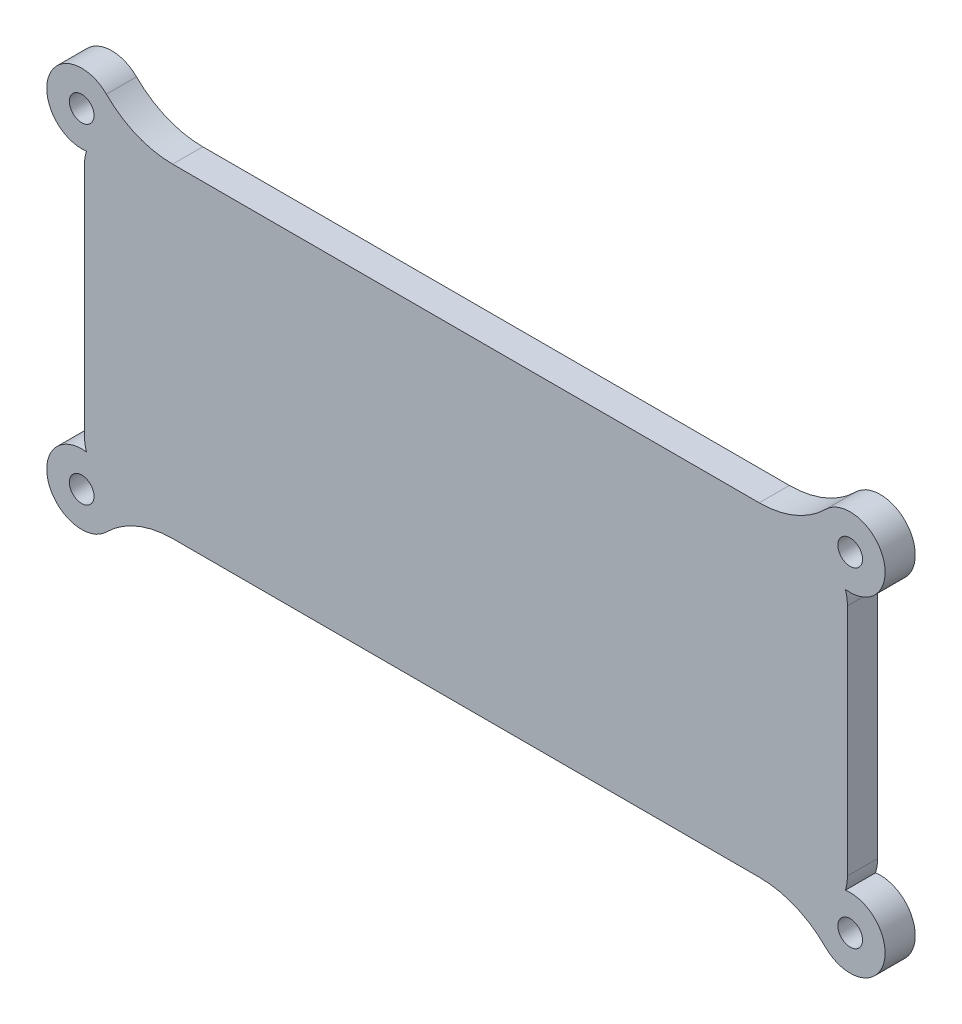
SolidWorks part; units mm, degrees
ref_plane "Front Plane" through (0, 0, 0) normal (0, 0, 1) x (1, 0, 0)
ref_plane "Top Plane" through (0, 0, 0) normal (0, 1, 0) x (1, 0, 0)
ref_plane "Right Plane" through (0, 0, 0) normal (1, 0, 0) x (0, 0, -1)
sketch "Sketch1" plane through (0, 0, 0) normal (0, 0, 1) x (1, 0, 0)
  line L1 (-127.6365, -9.672) -> (-127.6365, 29.788)
  line L4 (1.0748, -9.672) -> (1.0748, 29.788)
  line L5 (-112.7563, -17.292) -> (-13.8054, -17.292)
  line L7 (-13.8054, 37.408) -> (-112.7563, 37.408)
  circle A0 centre (1.537, -17.7542) radius 2.0828
  arc A15 (-13.8054, 37.408) -> (-2.6298, 42.0371) centre (-13.8054, 53.2126) ccw
  circle A16 centre (1.537, 37.8702) radius 2.0828
  arc A17 (0.7369, 32.032) -> (-2.6298, 42.0371) centre (1.537, 37.8702) ccw
  arc A20 (-2.6298, -21.9211) -> (0.7369, -11.916) centre (1.537, -17.7542) ccw
  arc A21 (-2.6298, -21.9211) -> (-13.8054, -17.292) centre (-13.8054, -33.0966) ccw
  circle A22 centre (-128.0987, -17.7542) radius 2.0828
  arc A23 (-112.7563, -17.292) -> (-123.9319, -21.9211) centre (-112.7563, -33.0966) ccw
  arc A24 (-127.2986, -11.916) -> (-123.9319, -21.9211) centre (-128.0987, -17.7542) ccw
  arc A27 (-123.9319, 42.0371) -> (-112.7563, 37.408) centre (-112.7563, 53.2126) ccw
  circle A28 centre (-128.0987, 37.8702) radius 2.0828
  arc A29 (-123.9319, 42.0371) -> (-127.2986, 32.032) centre (-128.0987, 37.8702) ccw
  spline S1 degree 3 poles (-127.6365, 29.788) (-127.6365, 30.261) (-127.5634, 31.0259) (-127.386, 31.7482) (-127.2986, 32.032) knots 0.511301 0.511301 0.511301 0.511301 0.517169 0.521126 0.521126 0.521126 0.521126
  spline S2 degree 2 poles (1.0748, 29.788) (1.0748, 30.8299) (0.7949, 31.8343) (0.7672, 31.9337) (0.7369, 32.032) knots 0 0 0 0.25 0.25 0.275715 0.275715 0.275715
  spline S3 degree 2 poles (-127.6365, -9.672) (-127.6365, -10.7139) (-127.3566, -11.7183) (-127.3289, -11.8177) (-127.2986, -11.916) knots 0 0 0 0.25 0.25 0.275715 0.275715 0.275715
  spline S5 degree 3 poles (1.0748, -9.672) (1.0748, -10.145) (1.0017, -10.9098) (0.8244, -11.6321) (0.7369, -11.916) knots 0.011301 0.011301 0.011301 0.011301 0.017169 0.021126 0.021126 0.021126 0.021126
extrude "Boss-Extrude1" add sketch "Sketch1" along normal blind 5.08
sketch "Sketch2" plane through (0, 0, 0) normal (0, 0, -1) x (-1, 0, 0)
  line L0 (54.8952, 15.138) -> (54.8952, 29.788)
  line L1 (54.8952, 29.788) -> (120.0165, 29.788)
  line L2 (120.0165, 29.788) -> (120.0165, -9.672)
  line L3 (120.0165, -9.672) -> (54.8952, -9.672)
  line L4 (54.8952, -9.672) -> (54.8952, 4.978)
  line L5 (53.6252, 15.138) -> (53.6252, 31.058)
  line L6 (53.6252, 31.058) -> (121.2865, 31.058)
  line L7 (121.2865, 31.058) -> (121.2865, -10.942)
  line L8 (121.2865, -10.942) -> (53.6252, -10.942)
  line L9 (53.6252, -10.942) -> (53.6252, 4.978)
  line L10 (53.6252, 4.978) -> (54.8952, 4.978)
  line L11 (53.6252, 15.138) -> (54.8952, 15.138)
  circle A1 centre (26.2752, 10.058) radius 4.5
  dimension "D1" = 1.27
extrude "Boss-Extrude2" add sketch "Sketch2" along normal blind 1.778
sketch "Sketch3" plane through (0, 0, 5.08) normal (0, 0, 1) x (1, 0, 0)
  line L12 (-13.8054, 37.408) -> (-6.5452, 37.408)
  line L13 (1.0748, 29.788) -> (1.0748, 22.5278)
  line L14 (1.0748, -2.4118) -> (1.0748, 22.5278)
  line L15 (1.0748, -2.4118) -> (1.0748, -9.672)
  line L16 (-6.5452, -17.292) -> (-13.8054, -17.292)
  line L17 (-112.7563, -17.292) -> (-13.8054, -17.292)
  line L18 (-112.7563, -17.292) -> (-120.0165, -17.292)
  line L19 (-127.6365, -9.672) -> (-127.6365, -2.4118)
  line L20 (-127.6365, 22.5278) -> (-127.6365, -2.4118)
  line L21 (-127.6365, 22.5278) -> (-127.6365, 29.788)
  line L22 (-120.0165, 37.408) -> (-112.7563, 37.408)
  line L23 (-13.8054, 37.408) -> (-112.7563, 37.408)
  line L25 (-106.7538, 46.8611) -> (-30.5538, 46.8611) construction
  line L26 (-106.7538, 46.8611) -> (-106.7538, -29.3389) construction
  line L27 (-106.7538, -29.3389) -> (-30.5538, -29.3389) construction
  line L28 (-30.5538, 46.8611) -> (-30.5538, -29.3389) construction
  arc A4 (1.0748, 29.788) -> (-6.5452, 37.408) centre (-6.5452, 29.788) ccw
  arc A5 (-6.5452, -17.292) -> (1.0748, -9.672) centre (-6.5452, -9.672) ccw
  arc A6 (-127.6365, -9.672) -> (-120.0165, -17.292) centre (-120.0165, -9.672) ccw
  arc A7 (-120.0165, 37.408) -> (-127.6365, 29.788) centre (-120.0165, 29.788) ccw
  dimension "D1" = 76.2
  dimension "D2" = 76.2
